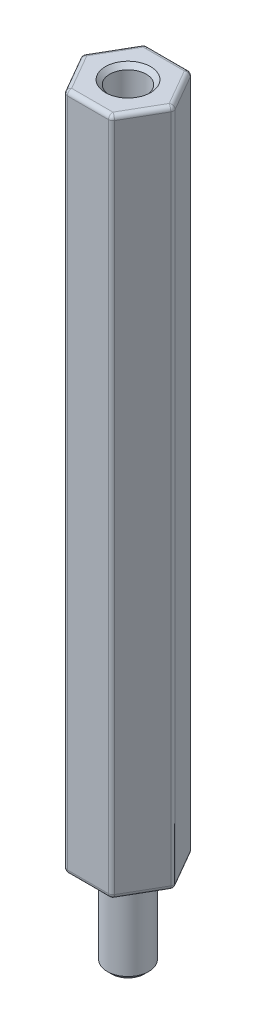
SolidWorks part; units mm, degrees
ref_plane "Front Plane" through (0, 0, 0) normal (0, 0, 1) x (1, 0, 0)
ref_plane "Top Plane" through (0, 0, 0) normal (0, 1, 0) x (1, 0, 0)
ref_plane "Right Plane" through (0, 0, 0) normal (1, 0, 0) x (0, 0, -1)
sketch "Sketch1" plane through (0, 0, 0) normal (0, 1, 0) x (1, 0, 0)
  line L1 (-1.5877, 2.75) -> (-3.1754, 0)
  line L2 (-3.1754, 0) -> (-1.5877, -2.75)
  line L3 (-1.5877, -2.75) -> (1.5877, -2.75)
  line L4 (1.5877, -2.75) -> (3.1754, 0)
  line L5 (3.1754, 0) -> (1.5877, 2.75)
  line L6 (1.5877, 2.75) -> (-1.5877, 2.75)
  circle A0 centre (0, 0) radius 2.75 construction
  circle A1 centre (0, 0) radius 1.25
  dimension "D2" = 2.5
  dimension "D1" = 5.5
extrude "Boss-Extrude1" add sketch "Sketch1" along normal blind 46.6
fillet "Fillet1" radius 0.3 6 edges at (1.5877, 23.3, -2.75) (3.1754, 23.3, 0) (-1.5877, 23.3, -2.75) (-3.1754, 23.3, 0) (-1.5877, 23.3, 2.75) (1.5877, 23.3, 2.75)
fillet "Fillet2" radius 0.3 24 edges at (-1.5645, 0, 2.7098) (-2.3816, 0, 1.375) (-3.129, 0, 0) (-2.3816, 0, -1.375) (-1.5645, 0, -2.7098) (0, 0, -2.75) (1.5645, 0, -2.7098) (2.3816, 0, -1.375) (3.129, 0, 0) (2.3816, 0, 1.375) (1.5645, 0, 2.7098) (-1.5645, 46.6, 2.7098) (-2.3816, 46.6, 1.375) (-3.129, 46.6, 0) (-2.3816, 46.6, -1.375) (-1.5645, 46.6, -2.7098) (0, 46.6, -2.75) (1.5645, 46.6, -2.7098) (2.3816, 46.6, -1.375) (3.129, 46.6, 0) (2.3816, 46.6, 1.375) (1.5645, 46.6, 2.7098) (0, 0, 2.75) (0, 46.6, 2.75)
sketch "Sketch2" plane through (0, 0, 0) normal (0, -1, 0) x (1, 0, 0)
  circle A0 centre (0, 0) radius 1.425
  dimension "D1" = 2.85
extrude "Boss-Extrude2" add sketch "Sketch2" along normal blind 6
chamfer "Chamfer1" distance 0.3 angle 45 2 edges at (0, 46.6, 1.25) (0, -6, -1.425)
fillet "Fillet3" radius 0.3 1 edges at (0, 0, 1.425)
